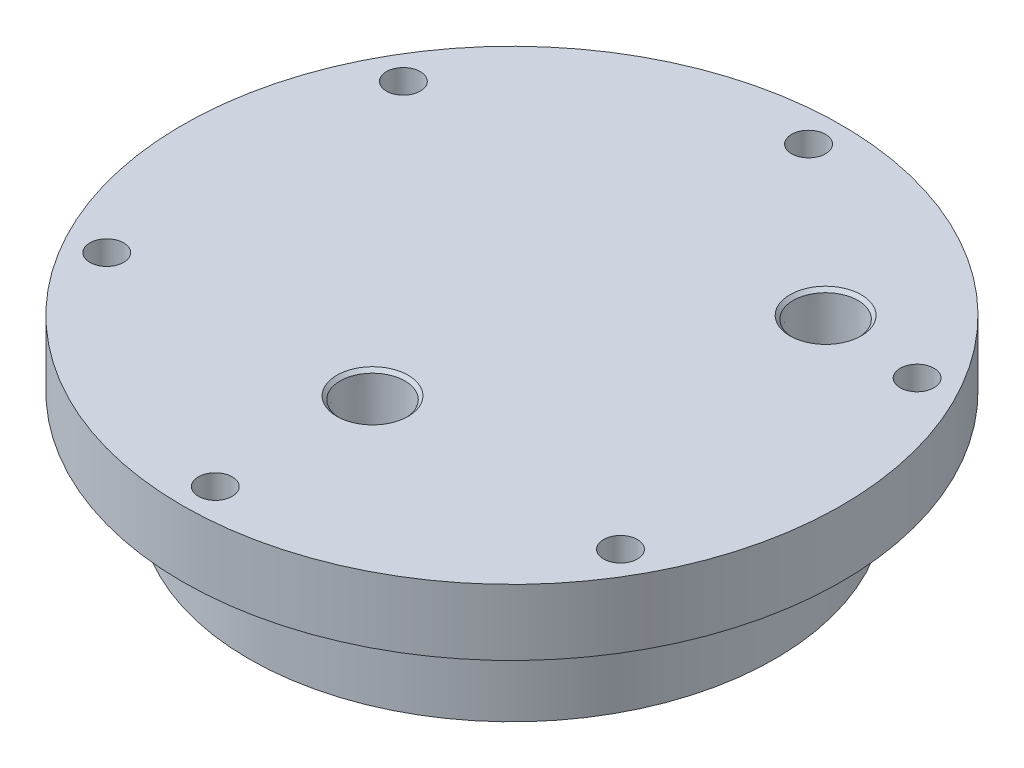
SolidWorks part; units mm, degrees
ref_plane "Front Plane" through (0, 0, 0) normal (0, 0, 1) x (1, 0, 0)
ref_plane "Top Plane" through (0, 0, 0) normal (0, 1, 0) x (1, 0, 0)
ref_plane "Right Plane" through (0, 0, 0) normal (1, 0, 0) x (0, 0, -1)
sketch "Sketch1" plane through (0, 0, 0) normal (0, 0, 1) x (1, 0, 0)
  line L0 (0, 0) -> (50.673, 0)
  line L1 (50.673, 0) -> (50.673, 19.304)
  line L2 (50.673, 19.304) -> (63.5, 19.304)
  line L3 (63.5, 19.304) -> (63.5, 32.004)
  line L4 (63.5, 32.004) -> (0, 32.004)
  line L5 (0, 32.004) -> (0, 0)
  line L6 (0, 0) -> (0, -16.4374) construction
  dimension "D1" = 101.346
  dimension "D2" = 19.304
  dimension "D3" = 127
  dimension "D4" = 12.7
revolve "Revolve1" add sketch "Sketch1" angle 360 about L6
hole_wizard "5/16-18 Tapped Hole1" positions "Sketch3" profile "Sketch4" tap size "5/16-18" standard "Example Inch"
sketch "Sketch3" plane through (0, 19.304, 0) normal (0, -1, 0) x (1, 0, 0)
  point P0 (0, 57.15)
  dimension "D1" = 57.15
sketch "Sketch4" plane through (0, 19.304, 57.15) normal (1, 0, 0) x (0, 0, -1)
  line L0 (0, 0) -> (0, 12.7)
  line L1 (0, 12.7) -> (3.2639, 12.7)
  line L2 (3.2639, 12.7) -> (3.2639, 0)
  line L5 (3.2639, 0) -> (0, 0)
  line L11 (0, -6.35) -> (0, 107.95) construction
  dimension "Thru Tap Drill Dia." = 6.5278
  dimension "Thru Tap Drill Depth" = 12.7
pattern_circular "CirPattern1" count 6 over 360 about axis through (0, 0, 0) along (0, 1, 0) of "5/16-18 Tapped Hole1"
sketch "Sketch5" plane through (0, 0, 0) normal (0, 0, 1) x (1, 0, 0)
  line L0 (20.5105, 0) -> (20.5105, 15.875)
  line L1 (20.5105, 15.875) -> (33.2105, 15.875)
  line L2 (33.2105, 15.875) -> (33.2105, 0)
  line L3 (33.2105, 0) -> (20.5105, 0)
  line L4 (36.3855, 0) -> (36.3855, 15.875)
  line L5 (36.3855, 15.875) -> (49.0855, 15.875)
  line L6 (49.0855, 15.875) -> (49.0855, 0)
  line L7 (49.0855, 0) -> (36.3855, 0)
  line L8 (50.673, 0) -> (50.673, 19.304) construction
  line L9 (-50.673, 0) -> (50.673, 0) construction
  line L10 (0, 0) -> (0, 10.9349) construction
  dimension "D1" = 1.5875
  dimension "D2" = 12.7
  dimension "D3" = 3.175
  dimension "D4" = 15.875
revolve "Cut-Revolve1" cut sketch "Sketch5" angle 360 about L10
sketch "Sketch6" plane through (0, 0, 0) normal (0, 0, 1) x (1, 0, 0)
  line L0 (49.0855, 0) -> (49.0855, 15.875) construction
  line L1 (36.3855, 0) -> (36.3855, 15.875) construction
  line L2 (33.2105, 0) -> (33.2105, 15.875) construction
  line L3 (20.5105, 0) -> (20.5105, 15.875) construction
  line L4 (49.0855, 0) -> (49.0855, 15.875)
  line L5 (36.3855, 0) -> (36.3855, 15.875)
  line L6 (33.2105, 0) -> (33.2105, 15.875)
  line L7 (20.5105, 0) -> (20.5105, 15.875)
  line L8 (20.5105, 0) -> (33.2105, 0) construction
  line L9 (36.3855, 0) -> (49.0855, 0) construction
  point P8 (42.7355, 0)
  point P9 (26.8605, 0)
hole_wizard "1/4 NPT Tapped Hole1" positions "Sketch8" profile "Sketch7" size "1/4" standard "Ansi Inch"
sketch "Sketch8" plane through (0, 32.004, 0) normal (0, 1, 0) x (-1, 0, 0)
  line L0 (0, 0) -> (0, 26.8605) construction
  line L3 (-30.2186, -30.2186) -> (0, 0) construction
  line L5 (-26.8605, 0) -> (0, 0) construction
  line L8 (0, 0) -> (-42.7355, 0) construction
  point P0 (0, 26.8605)
  point P1 (-30.2186, -30.2186)
  dimension "D1" = 45
sketch "Sketch7" plane through (0, 32.004, 26.8605) normal (1, 0, 0) x (0, 0, 1)
  line L0 (0, 0) -> (0, 16.129)
  line L1 (0, 16.129) -> (5.5626, 16.129)
  line L3 (5.5626, 16.129) -> (5.5626, 9.906)
  line L4 (5.5626, 9.906) -> (5.9627, 9.906)
  line L5 (5.9627, 9.906) -> (6.2403, 0.635)
  line L6 (6.2403, 0.635) -> (6.8753, 0)
  line L7 (6.8753, 0) -> (0, 0)
  line L8 (0, -6.35) -> (0, 107.95) construction
  line L9 (-6.2403, 0.635) -> (-6.8753, 0) construction
  line L11 (-5.5626, 9.906) -> (-5.9627, 9.906) construction
  line L12 (-5.9627, 9.906) -> (-6.2403, 0.635) construction
  dimension "Thru Tap Drill Dia." = 11.1252
  dimension "Thru Tap Drill Depth" = 16.129
  dimension "Thread Dia." = 12.4806
  dimension "Thread Angle" = 3.43
  dimension "Thread Depth" = 9.906
  dimension "Near C'Sink Dia." = 13.7506
  dimension "Near C'Sink Angle" = 90
